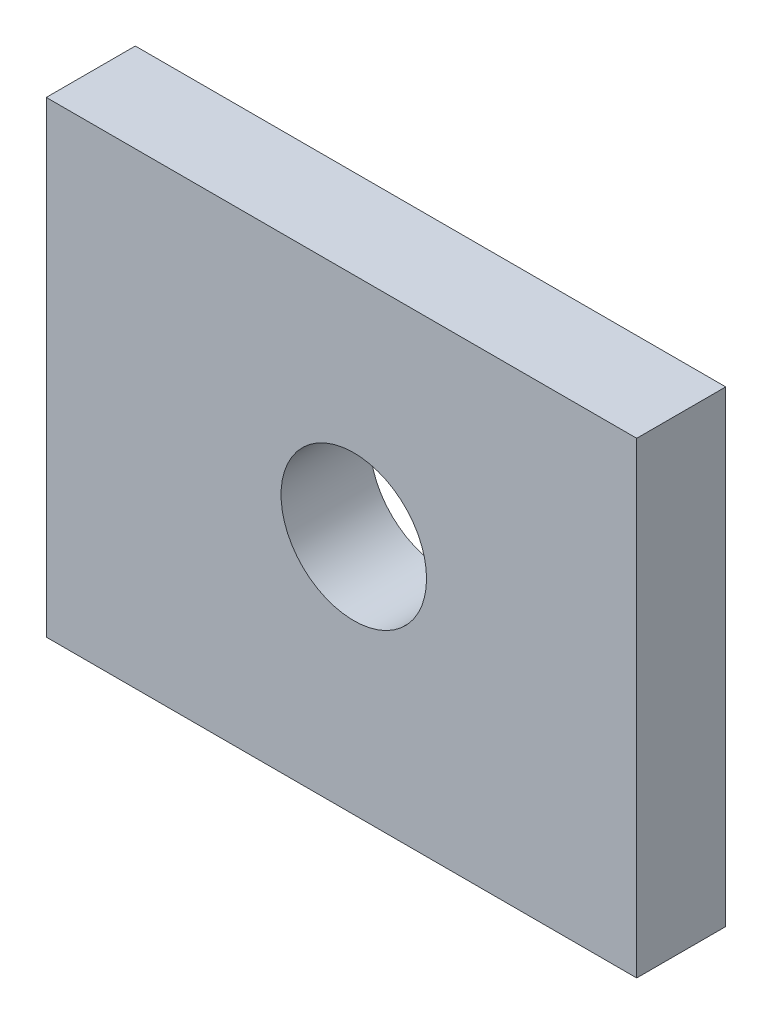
SolidWorks part; units mm, degrees
ref_plane "Plane1" through (0, 0, 0) normal (0, 0, 1) x (1, 0, 0)
ref_plane "Plane2" through (0, 0, 0) normal (0, 1, 0) x (1, 0, 0)
ref_plane "Plane3" through (0, 0, 0) normal (1, 0, 0) x (0, 0, -1)
sketch "Sketch1" plane through (0, 0, 0) normal (0, 0, 1) x (1, 0, 0)
  line L1 (-58.721, 43.2857) -> (54.0233, 43.2857)
  line L2 (-58.721, 43.2857) -> (-58.721, -45.9701)
  line L3 (-58.721, -45.9701) -> (54.0233, -45.9701)
  line L4 (54.0233, 43.2857) -> (54.0233, -45.9701)
extrude "Extrude1" add sketch "Sketch1" along normal mid plane 17
sketch "Sketch2" plane through (0, 0, 8.5) normal (0, 0, 1) x (1, 0, 0)
  circle A0 centre (0, 0) radius 13.8923
extrude "Cut-Extrude1" cut sketch "Sketch2" against normal through all
